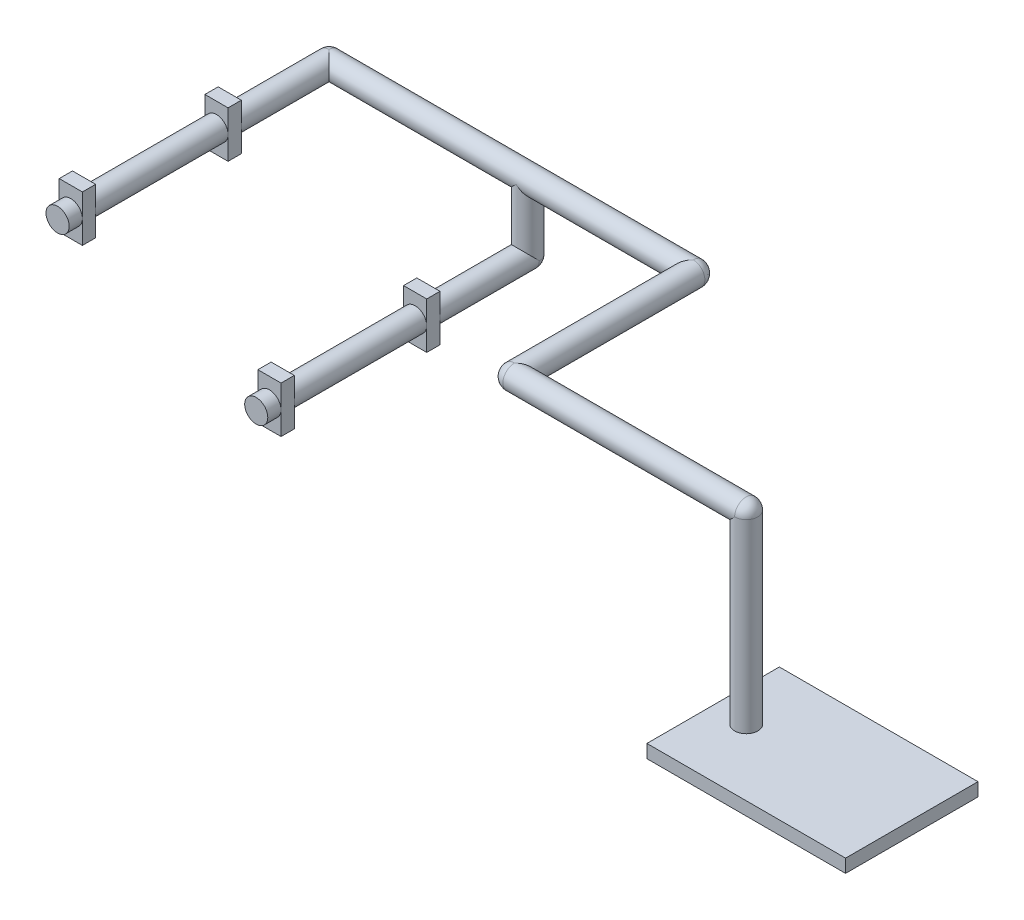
SolidWorks part; units mm, degrees
ref_plane "Face" through (0, 0, 0) normal (0, 0, 1) x (1, 0, 0)
ref_plane "Dessus" through (0, 0, 0) normal (0, 1, 0) x (1, 0, 0)
ref_plane "Droite" through (0, 0, 0) normal (1, 0, 0) x (0, 0, -1)
sketch "Esquisse1" plane through (0, 0, 0) normal (1, 0, 0) x (0, 0, -1)
  circle A0 centre (0, 0) radius 3.5
  dimension "D1" = 7
extrude "Extrusion1" add sketch "Esquisse1" along normal blind 50 and the other way blind 60
sketch "Esquisse2" plane through (0, 0, 0) normal (0, 1, 0) x (1, 0, 0)
  line L0 (50, 3.5) -> (-60, 3.5) construction
  circle A0 centre (0, 0) radius 3.5
extrude "Extrusion2" add sketch "Esquisse2" against normal blind 20
sketch "Esquisse3" plane through (0, 0, 0) normal (0, 0, 1) x (1, 0, 0)
  circle A0 centre (0, -19.9891) radius 3.5
extrude "Extrusion3" add sketch "Esquisse3" along normal blind 30
sketch "Esquisse4" plane through (0, 0, 0) normal (0, 0, 1) x (1, 0, 0)
  line L0 (-60, 3.5) -> (-60, -3.5) construction
  circle A0 centre (-60, 0) radius 3.5
extrude "Extrusion4" add sketch "Esquisse4" along normal blind 30
sketch "Esquisse5" plane through (0, 0, 30) normal (0, 0, 1) x (1, 0, 0)
  line L1 (-63.5, 7) -> (-56.5, 7)
  line L2 (-63.5, 7) -> (-63.5, -7)
  line L3 (-63.5, -7) -> (-56.5, -7)
  line L4 (-56.5, 7) -> (-56.5, -7)
  circle A1 centre (-60, 0) radius 3.5 construction
  dimension "D1" = 7
  dimension "D2" = 7
extrude "Extrusion5" add sketch "Esquisse5" along normal blind 4
sketch "Esquisse6" plane through (0, 0, 34) normal (0, 0, 1) x (1, 0, 0)
  line L0 (-60, 3.5) -> (-60, -3.5) construction
  circle A0 centre (-60, 0) radius 3.5
extrude "Extrusion6" add sketch "Esquisse6" along normal blind 40
sketch "Esquisse7" plane through (0, 0, 74) normal (0, 0, 1) x (1, 0, 0)
  line L3 (-63.5, 0) -> (-63.5, -7)
  line L4 (-63.5, -7) -> (-56.5, -7)
  line L5 (-56.5, -7) -> (-56.5, 0)
  line L6 (-63.5, 0) -> (-63.5, -7)
  line L7 (-63.5, -7) -> (-56.5, -7)
  line L8 (-56.5, -7) -> (-56.5, 0)
  line L9 (-56.5, 0) -> (-56.5, 7)
  line L10 (-56.5, 7) -> (-63.5, 7)
  line L11 (-63.5, 7) -> (-63.5, 0)
  line L12 (-56.5, 0) -> (-56.5, 7)
  line L13 (-56.5, 7) -> (-63.5, 7)
  line L14 (-63.5, 7) -> (-63.5, 0)
  arc A1 (-63.5, 0) -> (-56.5, 0) centre (-60, 0) ccw
  arc A3 (-56.5, 0) -> (-63.5, 0) centre (-60, 0) ccw
  dimension "D1" = 0
  dimension "D2" = 0
extrude "Extrusion7" add sketch "Esquisse7" along normal blind 4
sketch "Esquisse8" plane through (0, 0, 78) normal (0, 0, 1) x (1, 0, 0)
  line L0 (-60, 3.5) -> (-60, -3.5) construction
  circle A0 centre (-60, 0) radius 3.5
extrude "Extrusion8" add sketch "Esquisse8" along normal blind 4
sketch "Esquisse9" plane through (0, 0, 30) normal (0, 0, 1) x (1, 0, 0)
  line L0 (3.5, -19.9783) -> (3.5, -3.5) construction
  line L1 (-3.5, -12.9891) -> (3.5, -12.9891)
  line L2 (-3.5, -12.9891) -> (-3.5, -26.9891)
  line L3 (-3.5, -26.9891) -> (3.5, -26.9891)
  line L4 (3.5, -12.9891) -> (3.5, -26.9891)
  line L5 (-3.5, -3.5) -> (-3.5, -19.9783) construction
  circle A0 centre (0, -19.9891) radius 3.5 construction
  dimension "D2" = 7
  dimension "D1" = 7
extrude "Extrusion9" add sketch "Esquisse9" along normal blind 4
sketch "Esquisse10" plane through (0, 0, 34) normal (0, 0, 1) x (1, 0, 0)
  line L0 (-3.5, -20) -> (3.5, -20) construction
  circle A0 centre (0, -20) radius 3.4891
extrude "Extrusion10" add sketch "Esquisse10" along normal blind 40
sketch "Esquisse11" plane through (0, 0, 74) normal (0, 0, 1) x (1, 0, 0)
  line L4 (-3.5, -12.9891) -> (-3.5, -26.9891)
  line L5 (-3.5, -26.9891) -> (3.5, -26.9891)
  line L6 (3.5, -26.9891) -> (3.5, -12.9891)
  line L7 (3.5, -12.9891) -> (-3.5, -12.9891)
  line L8 (-3.5, -12.9891) -> (-3.5, -26.9891)
  line L9 (-3.5, -26.9891) -> (3.5, -26.9891)
  line L10 (3.5, -26.9891) -> (3.5, -12.9891)
  line L11 (3.5, -12.9891) -> (-3.5, -12.9891)
  dimension "D1" = 0
extrude "Extrusion11" add sketch "Esquisse11" along normal blind 4
sketch "Esquisse12" plane through (0, 0, 78) normal (0, 0, 1) x (1, 0, 0)
  circle A0 centre (0, -20) radius 3.4891 construction
  circle A1 centre (0, -20) radius 3.4891
extrude "Extrusion12" add sketch "Esquisse12" along normal blind 4
sketch "Esquisse13" plane through (0, 0, 0) normal (0, 0, 1) x (1, 0, 0)
  line L0 (50, -3.5) -> (50, 3.5) construction
  circle A0 centre (50, 0) radius 3.5
extrude "Extrusion13" add sketch "Esquisse13" along normal blind 54
sketch "Esquisse14" plane through (50, 0, 0) normal (1, 0, 0) x (0, 0, -1)
  line L0 (-54, 3.5) -> (-54, -3.5) construction
  circle A0 centre (-54, 0) radius 3.5
extrude "Extrusion14" add sketch "Esquisse14" along normal blind 70
sketch "Esquisse15" plane through (0, 0, 0) normal (0, 1, 0) x (1, 0, 0)
  line L0 (120, -57.5) -> (120, -50.5) construction
  circle A0 centre (120, -54) radius 3.5
extrude "Extrusion15" add sketch "Esquisse15" against normal blind 56
sketch "Esquisse17" plane through (0, -56, 0) normal (0, -1, 0) x (1, 0, 0)
  line L1 (110, 74) -> (170, 74)
  line L2 (110, 74) -> (110, 34)
  line L3 (110, 34) -> (170, 34)
  line L4 (170, 74) -> (170, 34)
  arc A0 (120, 50.5) -> (120, 57.5) centre (120, 54) ccw construction
  circle A1 centre (120, 54) radius 3.5 construction
  dimension "D1" = 10
  dimension "D4" = 20
  dimension "D2" = 50
  dimension "D3" = 20
extrude "Extrusion16" add sketch "Esquisse17" along normal blind 4
sketch "Esquisse18" plane through (0, 0, 0) normal (0, 1, 0) x (-1, 0, 0)
  line L0 (-120, 41.6807) -> (-120, 63.9528) construction
  line L1 (-120, 50.5) -> (-120, 57.5)
  line L2 (-120, 50.5) -> (-120, 57.5)
  arc A1 (-120, 57.5) -> (-120, 50.5) centre (-120, 54) ccw
  arc A2 (-120, 57.5) -> (-120, 50.5) centre (-120, 54) ccw
  dimension "D1" = 0
revolve "Révolution1" add sketch "Esquisse18" angle 360 about L0
sketch "Esquisse19" plane through (50, 0, 0) normal (-1, 0, 0) x (0, 0, 1)
  line L0 (54, 11.18) -> (54, -10.7962) construction
  line L1 (54, 3.5) -> (54, -3.5)
  line L2 (54, 3.5) -> (54, -3.5)
  arc A1 (54, -3.5) -> (54, 3.5) centre (54, 0) ccw
  arc A2 (54, -3.5) -> (54, 3.5) centre (54, 0) ccw
  dimension "D1" = 0
revolve "Révolution2" add sketch "Esquisse19" angle 360 about L0
sketch "Esquisse20" plane through (0, 0, 0) normal (0, 0, -1) x (-1, 0, 0)
  line L0 (-50, -7.9463) -> (-50, 7.0333) construction
  line L1 (-50, -3.5) -> (-50, 3.5)
  line L2 (-50, -3.5) -> (-50, 3.5)
  arc A1 (-50, 3.5) -> (-50, -3.5) centre (-50, 0) ccw
  arc A2 (-50, 3.5) -> (-50, -3.5) centre (-50, 0) ccw
  dimension "D1" = 0
revolve "Révolution3" add sketch "Esquisse20" angle 360 about L0
sketch "Esquisse21" plane through (0, 0, 0) normal (0, 0, -1) x (-1, 0, 0)
  line L0 (-8.1892, -20) -> (11.0079, -20) construction
  line L1 (3.5, -20) -> (-3.5, -20)
  line L2 (3.5, -20) -> (-3.5, -20)
  arc A1 (-3.5, -20) -> (3.5, -20) centre (0, -19.9891) ccw
  arc A2 (-3.5, -20) -> (3.5, -20) centre (0, -19.9891) ccw
  dimension "D1" = 0
revolve "Révolution4" add sketch "Esquisse21" angle 360 about L0
sketch "Esquisse22" plane through (-60, 0, 0) normal (-1, 0, 0) x (0, 0, 1)
  line L0 (0, -6.605) -> (0, 7.6564) construction
  line L1 (0, -3.5) -> (0, 3.5)
  line L2 (0, -3.5) -> (0, 3.5)
  arc A1 (0, 3.5) -> (0, -3.5) centre (0, 0) ccw
  arc A2 (0, 3.5) -> (0, -3.5) centre (0, 0) ccw
  dimension "D1" = 0
revolve "Révolution5" add sketch "Esquisse22" angle 360 about L0
